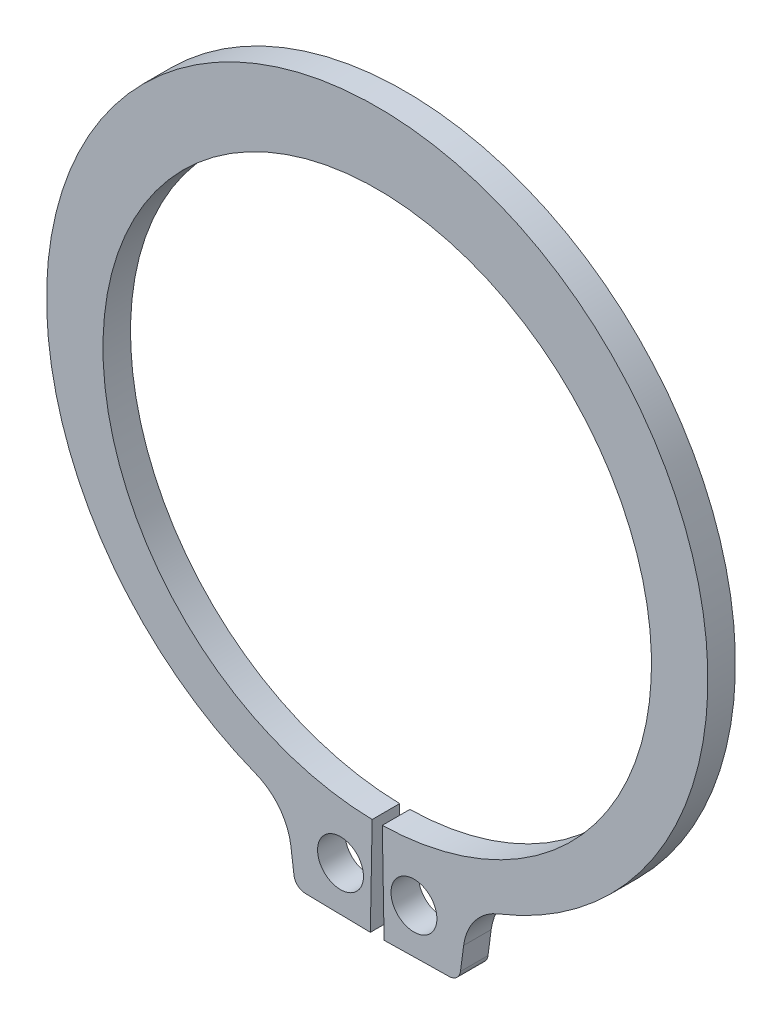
SolidWorks part; units mm, degrees
ref_plane "Plane1" through (0, 0, 0) normal (0, 0, 1) x (1, 0, 0)
ref_plane "Plane2" through (0, 0, 0) normal (0, 1, 0) x (1, 0, 0)
ref_plane "Plane3" through (0, 0, 0) normal (1, 0, 0) x (0, 0, -1)
extrude "Body" add sketch "BodySke" against normal blind 1.2
sketch "BodySke" plane through (0, 0, 0) normal (0, 0, 1) x (1, 0, 0)
  line L0 (-1.5431, 0) -> (1.5431, 0) construction
  line L1 (0, 0) -> (0, 15.05) construction
  line L2 (0.2206, -11.948) -> (0.3, -16.2472)
  line L3 (-0.2206, -11.948) -> (-0.3, -16.2472)
  line L4 (0, 0) -> (6.1837, -15.0275) construction
  line L5 (0, 0) -> (-6.1837, -15.0275) construction
  line L6 (0.3, -16.2472) -> (3.14, -16.1948)
  line L7 (3.7649, -14.709) -> (3.6265, -15.7601)
  line L8 (-3.7649, -14.709) -> (-3.6265, -15.7601)
  line L9 (-0.3, -16.2472) -> (-3.14, -16.1948)
  circle A0 centre (0, 0) radius 11.95 construction
  arc A1 (0.2206, -11.948) -> (-0.2206, -11.948) centre (0, 0) ccw
  arc A2 (5.2552, -12.771) -> (-5.2552, -12.771) centre (0, 0.6432) ccw construction
  arc A3 (0.3, -16.2472) -> (4.0693, -15.7322) centre (0, 0) ccw construction
  arc A4 (5.2882, -12.7581) -> (3.7649, -14.709) centre (6.1837, -15.0275) ccw
  arc A5 (-3.7649, -14.709) -> (-5.2882, -12.7581) centre (-6.1837, -15.0275) ccw
  arc A6 (-4.0693, -15.7322) -> (-0.3, -16.2472) centre (0, 0) ccw construction
  arc A7 (5.2882, -12.7581) -> (-5.2882, -12.7581) centre (0, 0.6432) ccw
  arc A8 (-3.879, -13.8417) -> (3.879, -13.8417) centre (0, 0) ccw construction
  circle A9 centre (1.6, -14.2857) radius 1
  circle A10 centre (-1.6, -14.2857) radius 1
  arc A11 (3.6265, -15.7601) -> (3.14, -16.1948) centre (3.1308, -15.6949) cw
  arc A12 (-3.6265, -15.7601) -> (-3.14, -16.1948) centre (-3.1308, -15.6949) ccw
  point P28 (3.6156, -15.8427)
  point P31 (-3.6156, -15.8427)
  dimension "GrooveDia" = 23.9
  dimension "D3" = 0.5
  dimension "LugRad" = 16.25
  dimension "HoleOffsetRad" = 14.375
  dimension "HoleDia" = 2
  dimension "D2" = 15
  dimension "LargeRad" = 15.05
  dimension "SmallRad" = 13.81
  dimension "Gap" = 0.6
  dimension "SmallAngle" = 44.734
  dimension "HoleSpacing" = 3.2
sketch "Clipboard" plane through (0, 0, 0) normal (0, 0, 1) x (1, 0, 0)
  line L0 (0, 0) -> (3.1, 0)
  line L1 (0, 0) -> (0, 1.86)
  line L2 (0, 0) -> (0, -4.3)
  circle A0 centre (0, 0) radius 1
  circle A1 centre (0, 0) radius 12.5
  dimension "HoleDia" = 2
  dimension "ShaftDia" = 25
  dimension "LargeSection" = 3.1
  dimension "SmallSection" = 1.86
  dimension "LugSection" = 4.3
equation "' \"ShaftDia@Clipboard\" = 10"
equation "' \"Thickness@Body\" = 1"
equation "' \"GrooveDia@BodySke\" = 9.6"
equation "' \"LugSection@Clipboard\" = 3.0"
equation "' \"LargeSection@Clipboard\" = 1.6"
equation "' \"HoleDia@Clipboard\" = 1.2"
equation "\"SmallSection@Clipboard\" =  \"LargeSection@Clipboard\" * 0.6"
equation "\"Gap@BodySke\" =  \"Thickness@Body\" / 2"
equation "\"LargeRad@BodySke\" =  \"GrooveDia@BodySke\" / 2 +  \"LargeSection@Clipboard\""
equation "\"SmallRad@BodySke\" =  \"GrooveDia@BodySke\" / 2 +  \"SmallSection@Clipboard\""
equation "\"LugRad@BodySke\" = \"GrooveDia@BodySke\" / 2 + \"LugSection@Clipboard\""
equation "\"HoleOffsetRad@BodySke\" = (  \"ShaftDia@Clipboard\" / 2 + \"LugRad@BodySke\" ) / 2"
equation "\"HoleSpacing@BodySke\" = \"Gap@BodySke\"  * 2 +  \"HoleDia@Clipboard\""
equation "\"HoleDia@BodySke\" =  \"HoleDia@Clipboard\""
equation "\"SmallAngle@BodySke\" = atn(\"HoleSpacing@BodySke\" / 2 / sqr(\"HoleOffsetRad@BodySke\"  * \"HoleOffsetRad@BodySke\" - (\"HoleSpacing@BodySke\" / 2) * (\"HoleSpacing@BodySke\" / 2) ))  * 7 * ( 180 / 3.141593)"
